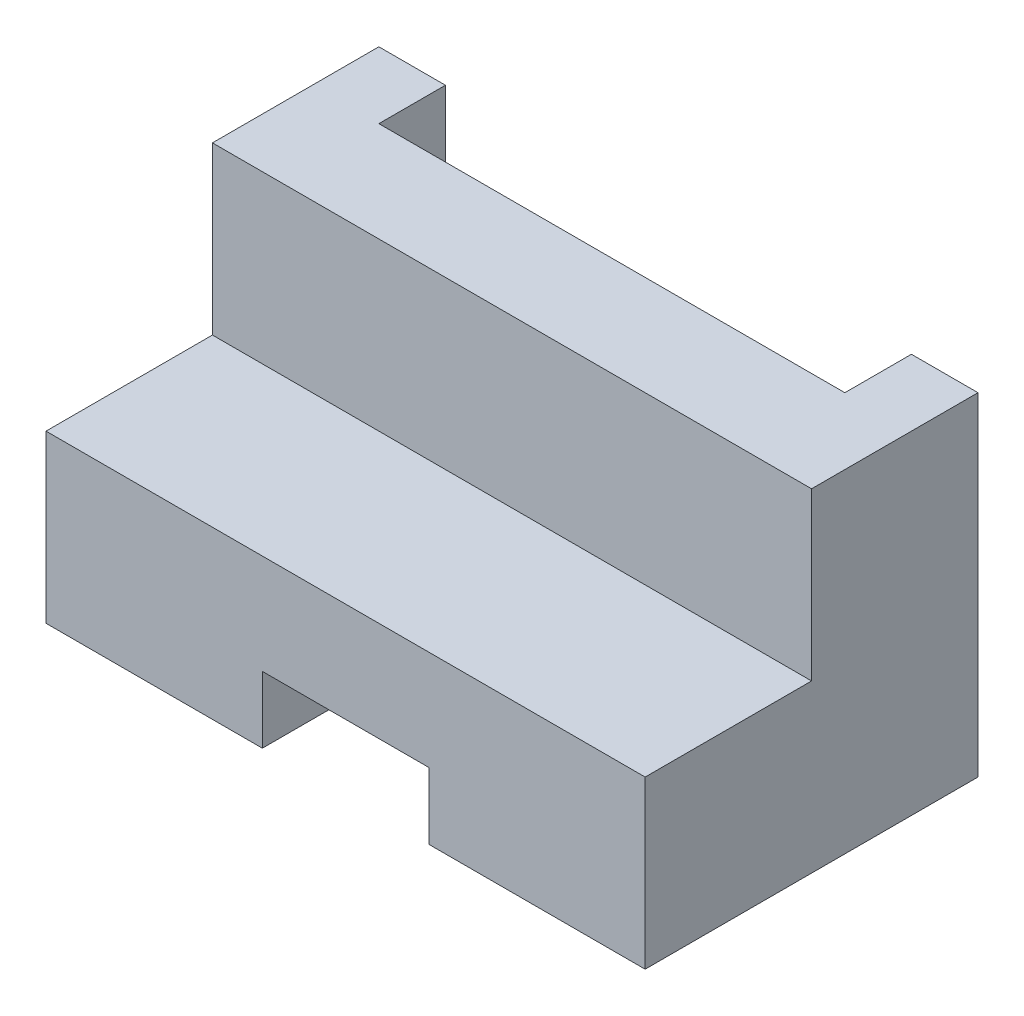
SolidWorks part; units mm, degrees
ref_plane "前视基准面" through (0, 0, 0) normal (0, 0, 1) x (1, 0, 0)
ref_plane "上视基准面" through (0, 0, 0) normal (0, 1, 0) x (1, 0, 0)
ref_plane "右视基准面" through (0, 0, 0) normal (1, 0, 0) x (0, 0, -1)
sketch "草图1" plane through (0, 0, 0) normal (0, 1, 0) x (1, 0, 0)
  line L1 (0, 0) -> (90, 0)
  line L2 (0, 0) -> (0, 50)
  line L3 (0, 50) -> (90, 50)
  line L4 (90, 0) -> (90, 50)
  dimension "D1" = 50
  dimension "D2" = 90
extrude "拉伸1" add sketch "草图1" along normal blind 25
sketch "草图2" plane through (0, 25, 0) normal (0, 1, 0) x (1, 0, 0)
  line L0 (90, 0) -> (90, 50) construction
  line L1 (0, 50) -> (90, 50)
  line L2 (0, 50) -> (0, 25)
  line L3 (0, 25) -> (90, 25)
  line L4 (90, 50) -> (90, 25)
extrude "拉伸2" add sketch "草图2" along normal blind 25
sketch "草图3" plane through (0, 50, 0) normal (0, 1, 0) x (1, 0, 0)
  line L0 (90, 50) -> (0, 50) construction
  line L1 (10, 50) -> (80, 50)
  line L2 (10, 50) -> (10, 40)
  line L3 (10, 40) -> (80, 40)
  line L4 (80, 50) -> (80, 40)
  line L5 (45, 50) -> (45, 14.3678) construction
  dimension "D1" = 10
  dimension "D2" = 70
extrude "切除-拉伸1" cut sketch "草图3" against normal through all
sketch "草图4" plane through (0, 0, 0) normal (0, 0, 1) x (1, 0, 0)
  line L1 (0, 0) -> (90, 0) construction
  line L2 (57.5, 0) -> (32.5, 0)
  line L3 (57.5, 0) -> (57.5, 10)
  line L4 (57.5, 10) -> (32.5, 10)
  line L6 (32.5, 0) -> (32.5, 10)
  line L7 (45, 0) -> (45, -8.3334) construction
  dimension "D1" = 10
  dimension "D2" = 25
extrude "切除-拉伸2" cut sketch "草图4" against normal through all
